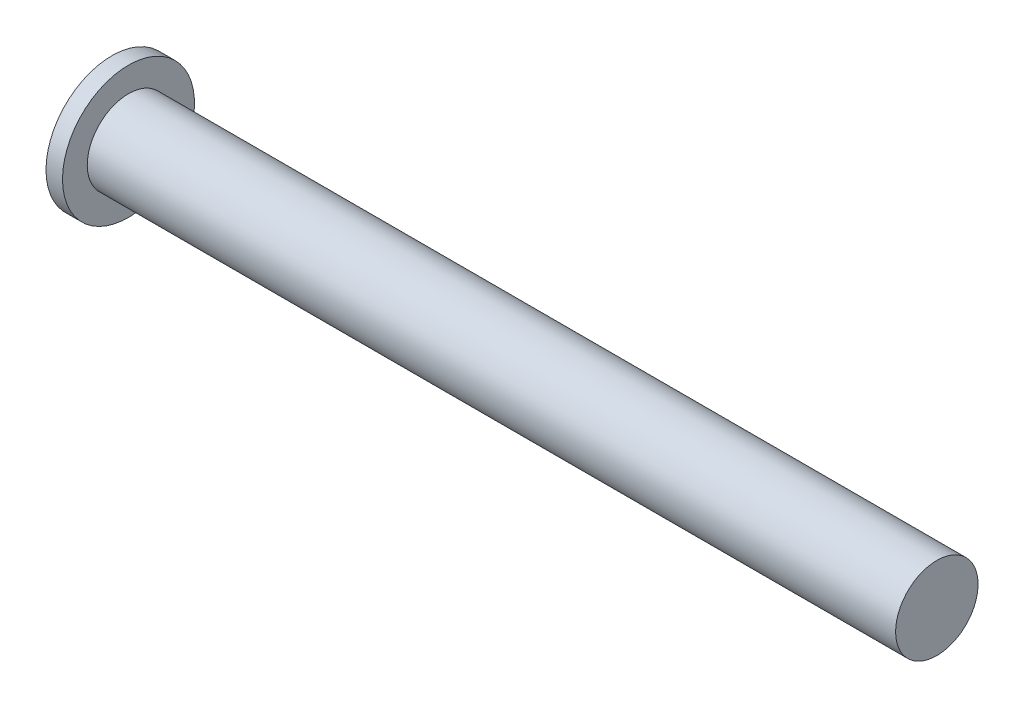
SolidWorks part; units mm, degrees
ref_plane "Front Plane" through (0, 0, 0) normal (0, 0, 1) x (1, 0, 0)
ref_plane "Top Plane" through (0, 0, 0) normal (0, 1, 0) x (1, 0, 0)
ref_plane "Right Plane" through (0, 0, 0) normal (1, 0, 0) x (0, 0, -1)
sketch "Sketch1" plane through (0, 0, 0) normal (0, 0, 1) x (1, 0, 0)
  line L0 (0, 0) -> (0, 4.8768)
  line L1 (0, 4.8768) -> (1.2192, 4.8768)
  line L2 (1.2192, 4.8768) -> (1.2192, 3.048)
  line L3 (1.2192, 3.048) -> (60.96, 3.048)
  line L4 (60.96, 3.048) -> (60.96, 0)
  line L5 (60.96, 0) -> (0, 0)
  line L6 (60.96, 0) -> (0, 0) construction
revolve "Revolve1" add sketch "Sketch1" angle 360 about L6
ref_plane "Plane1" through (60.96, 0, 0) normal (1, 0, 0) x (0, 0, -1)
